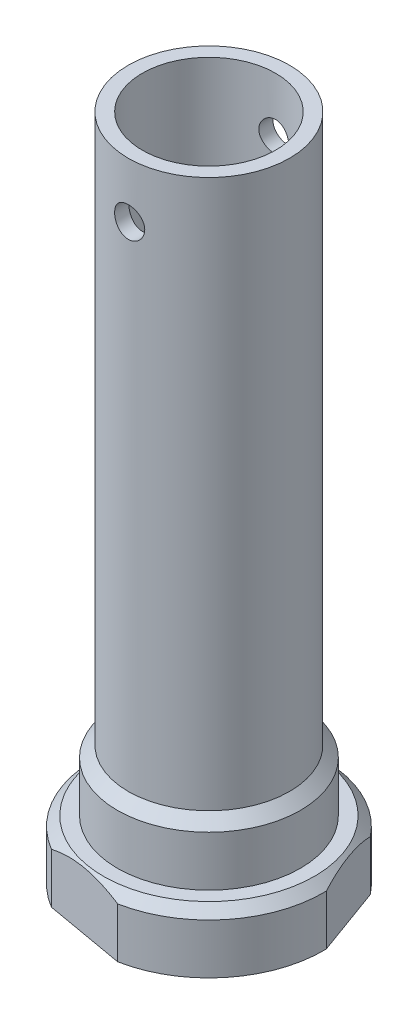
SolidWorks part; units mm, degrees
ref_plane "front" through (0, 0, 0) normal (0, 0, 1) x (1, 0, 0)
ref_plane "top" through (0, 0, 0) normal (0, 1, 0) x (1, 0, 0)
ref_plane "side" through (0, 0, 0) normal (1, 0, 0) x (0, 0, -1)
sketch "Sketch1" plane through (0, 0, 0) normal (0, 0, 1) x (1, 0, 0)
  line L0 (0, 0) -> (12.446, 0)
  line L1 (50, 0) -> (-50, 0) construction
  line L2 (12.446, 0) -> (12.446, 6.4516)
  line L3 (12.446, 6.4516) -> (9.9187, 6.4516)
  line L4 (9.9187, 6.4516) -> (9.9187, 11.8872)
  line L5 (9.9187, 11.8872) -> (8.7376, 13.0683)
  line L6 (8.7376, 13.0683) -> (8.7376, 72.4916)
  line L7 (8.7376, 72.4916) -> (7.2263, 72.4916)
  line L8 (7.2263, 72.4916) -> (7.2263, 4.8514)
  line L9 (7.2263, 4.8514) -> (0, 4.8514)
  line L10 (0, -50) -> (0, 50) construction
  line L11 (0, 4.8514) -> (0, 0)
  line L12 (0, 0) -> (0, 64.597) construction
  dimension "D1" = 67.6402
  dimension "D2" = 72.4916
  dimension "D3" = 6.4516
  dimension "D4" = 11.8872
  dimension "D5" = 45
  dimension "D6" = 14.4526
  dimension "D7" = 17.4752
  dimension "D8" = 19.8374
  dimension "D9" = 24.892
revolve "Revolve1" add sketch "Sketch1" angle 360 about L12
sketch "Sketch2" plane through (0, 0, 0) normal (0, 0, 1) x (1, 0, 0)
  line L1 (8.7376, 72.4916) -> (-8.7376, 72.4916) construction
  line L2 (0, -50) -> (0, 50) construction
  circle A0 centre (0, 66.5163) radius 1.6319
  point P4 (0, 0)
  dimension "D1" = 3.2639
  dimension "D2" = 4.3434
extrude "Cut-Extrude1" cut sketch "Sketch2" against normal mid plane 45.72
sketch "Sketch3" plane through (0, 0, 0) normal (0, 1, 0) x (1, 0, 0)
  line L0 (0, 0) -> (-3.3429, -18.9583) construction
  line L1 (-22.0366, -7.927) -> (17.9964, -14.9859)
  line L2 (0, 0) -> (25.319, 9.2154) construction
  line L3 (0, 0) -> (-14.8484, 12.4592) construction
  line L4 (0, -50) -> (0, 50) construction
  line L5 (4.0931, 23.2131) -> (17.9964, -14.9859)
  line L6 (4.0931, 23.2131) -> (-22.0366, -7.927)
  circle A12 centre (0, 0) radius 12.446 construction
  point P15 (7.2377, 14.5734)
  point P16 (-2.2201, 15.6894)
  point P17 (15.9042, -9.243)
  point P18 (12.1957, -13.9631)
  dimension "D1" = 24.2316
  dimension "D6" = 24.0792
  dimension "D2" = 120
  dimension "D3" = 120
  dimension "D4" = 10
  dimension "D5" = 24.2316
extrude "Cut-Extrude2" cut sketch "Sketch3" along normal blind 22.86 flip side to cut
chamfer "Chamfer1" distance 1.016 angle 45 1 edges at (9.6773, 6.4516, 7.8264)
